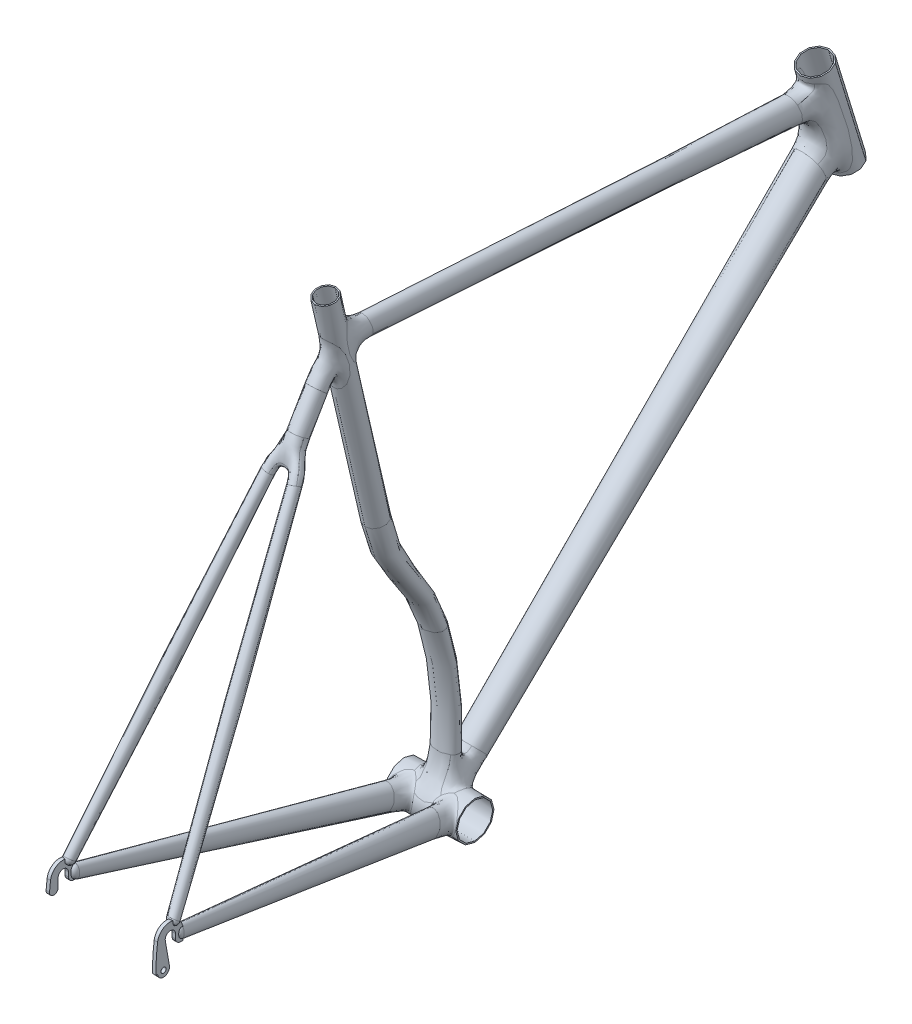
SolidWorks part; units mm, degrees
other "Top Tube"
other "Bottom Bracket"
other "Seat Tube, Lower "
other "Seat Tube, Upper "
other "Down Tube"
other "Head Tube"
other "Dropout, Left"
other "Dropout, Right"
other "Chain Stay, Right"
other "Chain Stay, Left"
other "Seat Stay, Right"
other "Seat Stay, Left"
ref_plane "Front Plane" through (0, 0, 0) normal (0, 0, 1) x (1, 0, 0)
ref_plane "Top Plane" through (0, 0, 0) normal (0, 1, 0) x (1, 0, 0)
ref_plane "Right Plane" through (0, 0, 0) normal (1, 0, 0) x (0, 0, -1)
sketch "Tube Centerlines" plane through (0, 0, 0) normal (1, 0, 0) x (0, 0, -1)
  line L0 (378.0551, 266.7) -> (837.7165, 719.7458)
  line L1 (378.0551, 266.7) -> (435.3368, 463.7667) construction
  line L2 (851.0837, 676.0236) -> (815.4378, 792.6162)
  line L3 (378.0551, 266.7) -> (0, 350)
  line L4 (0, 350) -> (256.6378, 792.6162)
  line L5 (256.6378, 792.6162) -> (826.5771, 756.181)
  line L6 (256.6378, 792.6162) -> (378.0551, 266.7) construction
  line L7 (0, 55) -> (0, -55) construction
  dimension "D1" = 45.72
  dimension "D2" = 38.1
  dimension "D3" = 38.1
  dimension "D4" = 72.32
  dimension "D5" = 116.448
  dimension "D6" = 122.989
  dimension "D7" = 539.75
  dimension "D8" = 17
imported_body "Tube Cap 1"
imported_body "Tube Cap 2"
imported_body "Tube Cap 3"
imported_body "Tube Cap 4"
imported_body "Chain Stay, Left"
imported_body "Seat Stay, Left"
imported_body "Chain Stay, Right"
imported_body "Seat Stay, Right"
imported_body "Seat Stay, Center"
imported_body "Top Tube"
imported_body "Bottom Bracket"
imported_body "Seat Tube, Lower"
imported_body "Seat Tube, Upper"
imported_body "Down Tube"
imported_body "Head Tube"
imported_body "Dropout, Right"
imported_body "Dropout, Left"
surface "Chain Stay, Right Knit"
surface "Chain Stay, Left Knit"
surface "Seat Stay, Right Knit"
surface "Seat Stay, Left Knit"
ref_plane "Plane1" through (0, 368.5924, -107.1393) normal (0, 0.9603, -0.2791) x (1, 0, 0)
sketch "Upper Seat Tube Blend" plane through (0, 0, 0) normal (1, 0, 0) x (0, 0, -1)
  line L0 (269.5687, 821.0693) -> (283.2907, 761.6327) construction
  line L1 (303.7763, 588.437) -> (245.2103, 842.1142) construction
  line L2 (285.8531, 812.7692) -> (294.2886, 776.2314)
  line L4 (256.6378, 792.6162) -> (826.5771, 756.181) construction
  line L5 (256.6378, 792.6162) -> (378.0551, 266.7) construction
  line L6 (259.1346, 787.3581) -> (293.7247, 795.3439) construction
  ellipse E0 centre (276.4297, 791.351) end of major axis (269.5687, 821.0693) minor radius 17.75 (285.8531, 812.7692) -> (294.2886, 776.2314) ccw
  dimension "D1" = 61
  dimension "D2" = 35.5
  dimension "D3" = 19
  dimension "D4" = 33
sketch "Head Tube Blend" plane through (0, 0, 0) normal (1, 0, 0) x (0, 0, -1)
  arc A0 (782.7914, 778.2013) -> (785.9539, 768.5651) centre (627.0633, 721.7563) cw
  arc A1 (796.4719, 717.05) -> (803.6708, 702.9583) centre (634.0743, 625.2026) cw
  arc A2 (785.9539, 768.5651) -> (790.675, 747.6116) centre (627.0633, 721.7563) cw
  arc A3 (790.675, 747.6116) -> (792.0611, 736.3508) centre (627.0633, 721.7563) cw
  arc A4 (803.6708, 702.9583) -> (813.5251, 676.2549) centre (634.0743, 625.2026) cw
  arc A5 (813.5251, 676.2549) -> (816.3144, 665.1709) centre (634.0743, 625.2026) cw
  spline S0 degree 3 poles (791.0459, 779.6038) (795.7312, 780.3476) (800.4165, 781.0915) (804.099, 781.4265) knots 0 0 0 0 0.078134 0.078134 0.078134 0.078134
  spline S1 degree 3 poles (835.129, 674.9911) (832.3021, 673.2012) (824.3083, 669.186) (816.3144, 665.1709) knots 0.926015 0.926015 0.926015 0.926015 1 1 1 1
  spline S2 degree 3 poles (804.099, 781.4265) (810.9979, 782.0541) (819.3231, 775.748) (833.5498, 733.4658) (841.4995, 708.3482) (842.9574, 680.3232) (837.172, 676.2847) (835.129, 674.9911) knots 0.078134 0.078134 0.078134 0.078134 0.166979 0.457547 0.746011 0.872546 0.926015 0.926015 0.926015 0.926015
sketch "Lower Seat Tube Blend" plane through (0, 0, 0) normal (1, 0, 0) x (0, 0, -1)
  line L0 (399.2769, 319.0604) -> (406.245, 311.9906)
  line L1 (353.8646, 319.0555) -> (379.1969, 317.6256)
  line L3 (406.245, 311.9906) -> (422.9164, 295.0757)
  line L4 (422.9164, 295.0757) -> (430.2528, 287.6322)
  line L5 (393.6721, 316.8086) -> (398.9212, 316.5123)
  line L6 (379.1969, 317.6256) -> (393.6721, 316.8086)
  line L7 (378.0551, 266.7) -> (837.7165, 719.7458) construction
sketch "Bottom Bracket Blend" plane through (0, -383.8478, -2695.7663) normal (0, -0.9603, 0.2791) x (1, 0, 0)
  line L2 (0, 2438.9275) -> (0, 2375.4275) construction
  line L3 (0, 2365.4934) -> (0, 3026.0392) construction
  line L5 (-25, 2407.1775) -> (25, 2407.1775) construction
  ellipse E0 centre (0, 2407.1775) end of major axis (0, 2375.4275) minor radius 25 (-17.282, 2430.1197) -> (-17.282, 2384.2354) ccw
  ellipse E1 centre (0, 2407.1775) end of major axis (0, 2438.9275) minor radius 25 (17.282, 2430.1197) -> (-17.282, 2430.1197) ccw
  ellipse E2 centre (0, 2407.1775) end of major axis (0, 2438.9275) minor radius 25 (-17.282, 2384.2354) -> (17.282, 2384.2354) ccw
  ellipse E3 centre (0, 2407.1775) end of major axis (0, 2438.9275) minor radius 25 (17.282, 2384.2354) -> (17.282, 2430.1197) ccw
  dimension "D1" = 50
  dimension "D2" = 63.5
surface "Surface-Trim1"
surface "Surface-Loft1"
surface "Surface-Trim2"
other "Boundary-Surface1"
other "Boundary-Surface2"
other "Boundary-Surface3"
surface "Surface-Fill1"
mirror "Mirror1" about plane through (0, 0, 0) normal (1, 0, 0)
surface "Surface-Knit1"
surface "Surface-Trim3"
wrap "Wrap1" sketch "Bottom Bracket Blend" wrap type scribe source sketch "Bottom Bracket Blend"
other "DeleteFace1"
surface "Surface-Loft2"
surface "Surface-Loft3"
surface "Surface-Loft4"
surface "Surface-Fill2"
surface "Surface-Fill3"
surface "Surface-Knit2"
sketch "Seat Stay Blend " plane through (0, 0, 0) normal (1, 0, 0) x (0, 0, -1)
  line L0 (216.1796, 768.997) -> (250.7204, 741.8761)
  ellipse E0 centre (237.7358, 772.3537) end of major axis (224.5435, 802.7431) minor radius 21.4077 (216.1796, 768.997) -> (250.7204, 741.8761) cw
surface "Surface-Loft5"
surface "Surface-Trim4"
surface "Surface-Loft6"
ref_plane "Seat Stay Plane" through (0, 88.0615, 151.8772) normal (0, -0.5016, -0.8651) x (0, 0.8651, -0.5016)
sketch "Sketch1" plane through (0, 88.0615, 151.8772) normal (0, -0.5016, -0.8651) x (0, 0.8651, -0.5016)
  line L0 (729, -26.7548) -> (729, -9.5)
  line L1 (729, 0) -> (677.9631, 0) construction
  line L2 (814.4212, 0) -> (420.3549, 0) construction
  line L3 (695.2932, -41.2838) -> (690.0804, -20.3762)
  line L4 (690.0804, 20.3762) -> (687.6611, 10.6733)
  line L5 (729, 9.5) -> (729, 26.7548)
  line L6 (729, -9.5) -> (729, 9.5)
  line L7 (687.6611, 10.6733) -> (685, 0)
  line L8 (695.2932, 41.2838) -> (690.0804, 20.3762)
  line L9 (687.6611, -10.6733) -> (685, 0)
  line L10 (690.0804, -20.3762) -> (687.6611, -10.6733)
  dimension "D1" = 76
  dimension "D2" = 44
  dimension "D3" = 685
  dimension "D4" = 19
  dimension "D5" = 11
  dimension "D6" = 21
surface "Surface-Trim5"
other "Boundary-Surface4"
other "Boundary-Surface5"
other "Boundary-Surface6"
surface "Surface-Fill4"
surface "Surface-Fill5"
surface "Surface-Offset1" parameters "D1"=4.5
surface "Surface-Trim6"
surface "Surface-Trim7"
sketch "Sketch2" plane through (0, 0, 0) normal (1, 0, 0) x (0, 0, -1)
  line L0 (347.6944, 305.5077) -> (333.7186, 242.0789)
  line L1 (378.0551, 266.7) -> (0, 350) construction
  dimension "D1" = 38
surface "Surface-Trim8"
other "Boundary-Surface7"
other "Boundary-Surface8"
surface "Surface-Plane1"
surface "Surface-Knit3"
shell "Shell1" thickness 1.5
